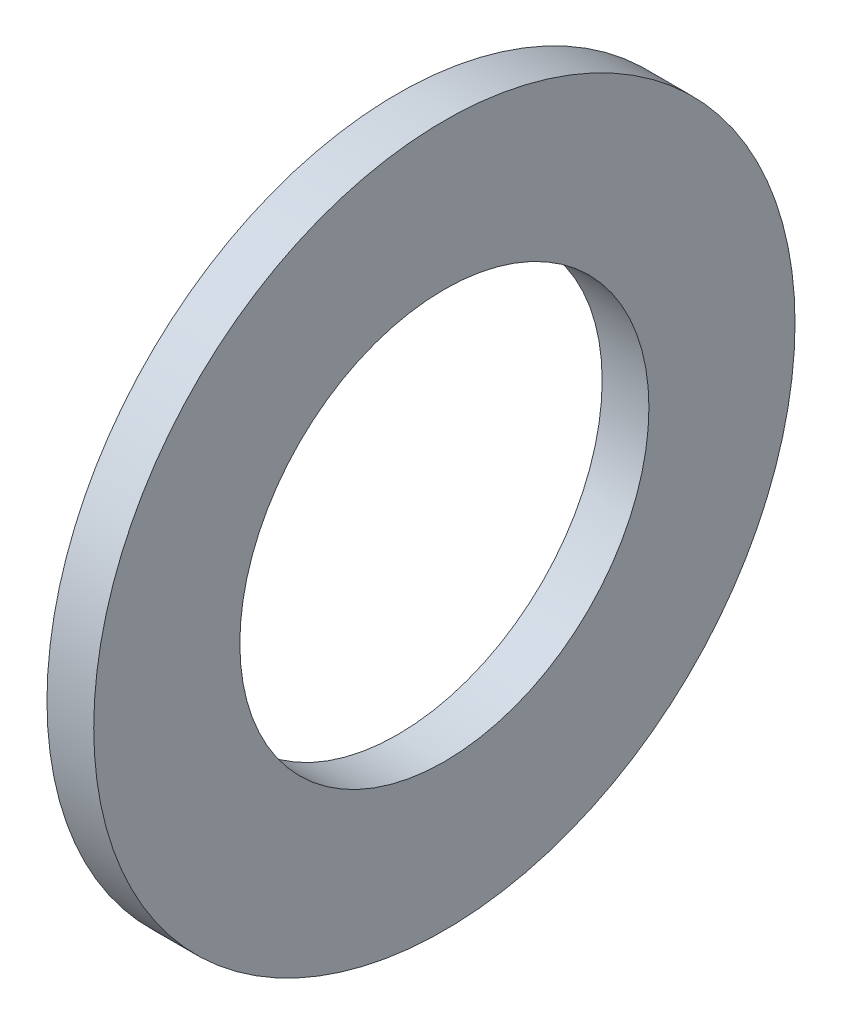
SolidWorks part; units mm, degrees
ref_plane "Face" through (0, 0, 0) normal (0, 0, 1) x (1, 0, 0)
ref_plane "Dessus" through (0, 0, 0) normal (0, 1, 0) x (1, 0, 0)
ref_plane "Droite" through (0, 0, 0) normal (1, 0, 0) x (0, 0, -1)
sketch "Esquisse1" plane through (0, 0, 0) normal (0, 0, 1) x (1, 0, 0)
  line L0 (0, 0) -> (52.3383, 0) construction
  line L2 (0, 3) -> (0.4, 3)
  line L3 (0, 3) -> (0, 1.75)
  line L4 (0, 1.75) -> (0.4, 1.75)
  line L5 (0.4, 3) -> (0.4, 1.75)
  dimension "D1" = 3.5
  dimension "D2" = 6
  dimension "D3" = 0.4
revolve "Base-Révolution" add sketch "Esquisse1" angle 360 about L0
